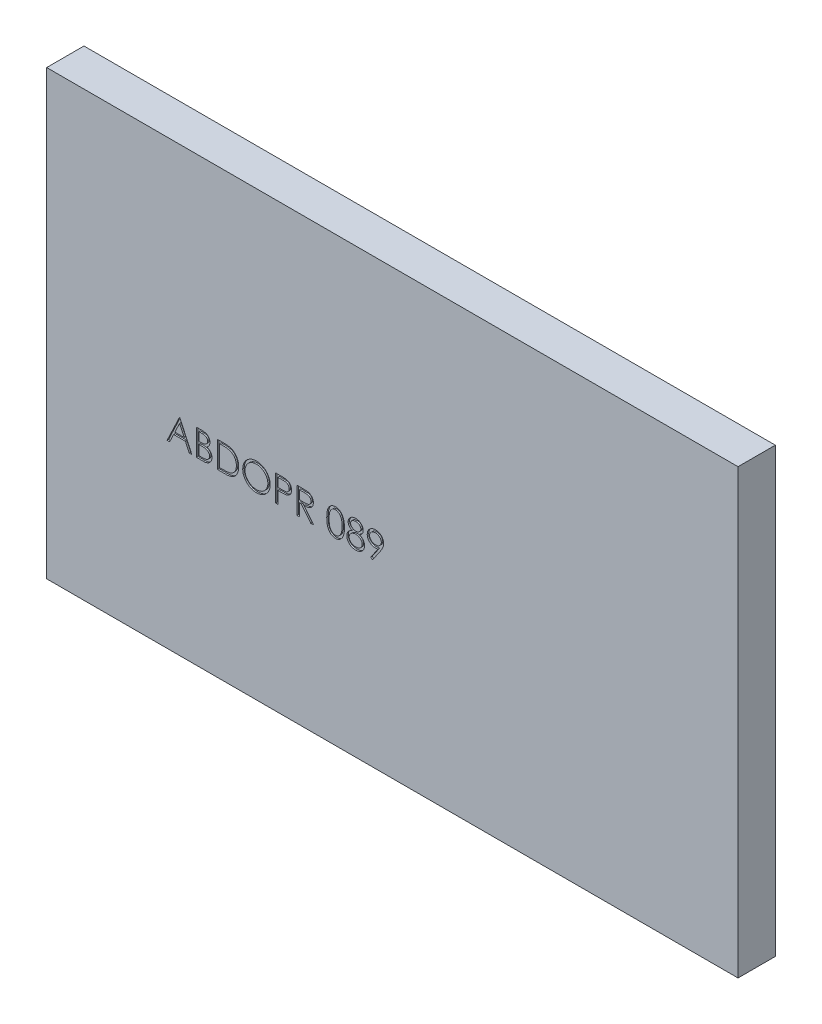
SolidWorks part; units mm, degrees
ref_plane "Ebene vorne" through (0, 0, 0) normal (0, 0, 1) x (1, 0, 0)
ref_plane "Ebene oben" through (0, 0, 0) normal (0, 1, 0) x (1, 0, 0)
ref_plane "Ebene rechts" through (0, 0, 0) normal (1, 0, 0) x (0, 0, -1)
sketch "Skizze1" plane through (0, 0, 0) normal (0, 0, 1) x (1, 0, 0)
  line L1 (0, 0) -> (92.6937, 0)
  line L2 (0, 0) -> (0, 59.3713)
  line L3 (0, 59.3713) -> (92.6937, 59.3713)
  line L4 (92.6937, 0) -> (92.6937, 59.3713)
extrude "Linear austragen1" add sketch "Skizze1" against normal blind 5
sketch "Skizze2" plane through (0, 0, 0) normal (0, 0, 1) x (1, 0, 0)
  text T0 "ABDOPR 089"
extrude "Schnitt-Linear austragen1" cut sketch "Skizze2" against normal blind 0.2
equation "\"LÄNGE\"=0"
equation "\"BREITE\"=0"
equation "\"HÖHE\"=0"
equation "\"DURCHMESSER\"=0"
equation "\"Stückzahl\"= 1"
